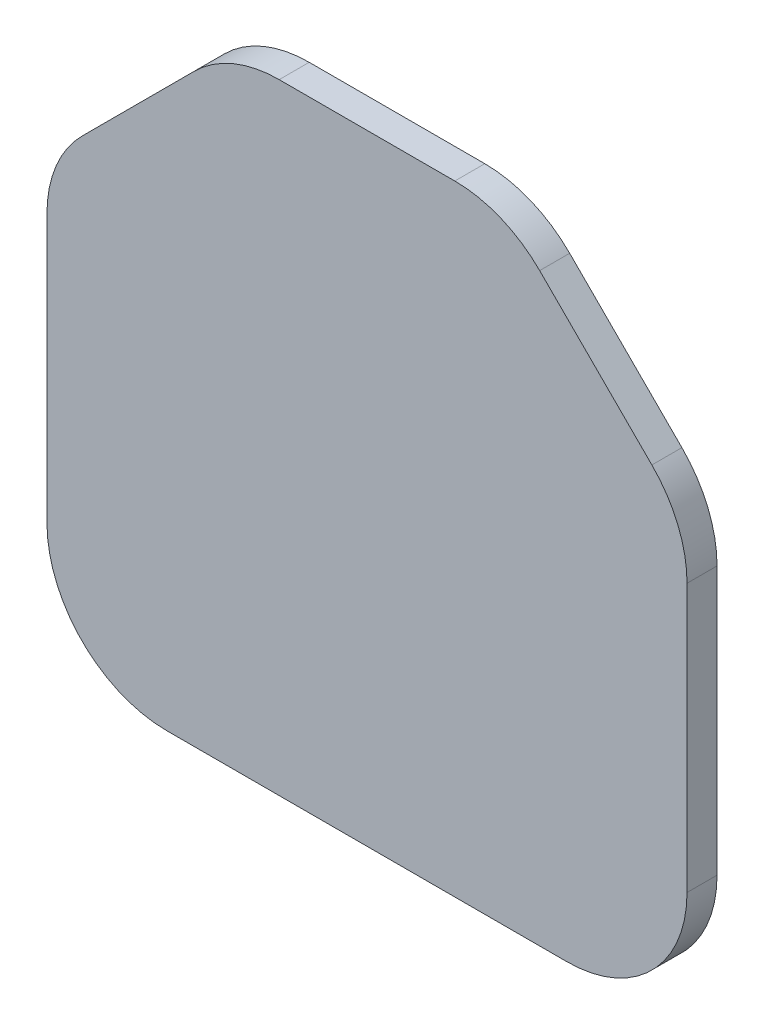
SolidWorks part; units mm, degrees
ref_plane "Face" through (0, 0, 0) normal (0, 0, 1) x (1, 0, 0)
ref_plane "Dessus" through (0, 0, 0) normal (0, 1, 0) x (1, 0, 0)
ref_plane "Droite" through (0, 0, 0) normal (1, 0, 0) x (0, 0, -1)
sketch "Esquisse1" plane through (0, 0, 0) normal (0, 0, 1) x (1, 0, 0)
  line L0 (-32, 9.7794) -> (-32, -17)
  line L1 (-20, -29) -> (20, -29)
  line L2 (32, -17) -> (32, 9.7794)
  line L3 (28.4853, 18.2647) -> (17.2647, 29.4853)
  line L4 (8.7794, 33) -> (-8.7794, 33)
  line L5 (-17.2647, 29.4853) -> (-28.4853, 18.2647)
  arc A0 (32, 9.7794) -> (28.4853, 18.2647) centre (20, 9.7794) ccw
  arc A1 (17.2647, 29.4853) -> (8.7794, 33) centre (8.7794, 21) ccw
  arc A2 (-8.7794, 33) -> (-17.2647, 29.4853) centre (-8.7794, 21) ccw
  arc A3 (-32, 9.7794) -> (-28.4853, 18.2647) centre (-20, 9.7794) cw
  arc A4 (-32, -17) -> (-20, -29) centre (-20, -17) ccw
  arc A5 (20, -29) -> (32, -17) centre (20, -17) ccw
  point P11 (13.75, 33)
  point P15 (-13.75, 33)
  point P18 (-32, 14.75)
  point P21 (-32, -29)
  point P24 (32, -29)
  dimension "D7" = 27.5
  dimension "D9" = 12
  dimension "D1" = 32
  dimension "D2" = 64
  dimension "D3" = 62
  dimension "D4" = 29
  dimension "D5" = 135
  dimension "D6" = 135
  dimension "D8" = 18.25
extrude "Base-Extrusion" add sketch "Esquisse1" along normal blind 3
